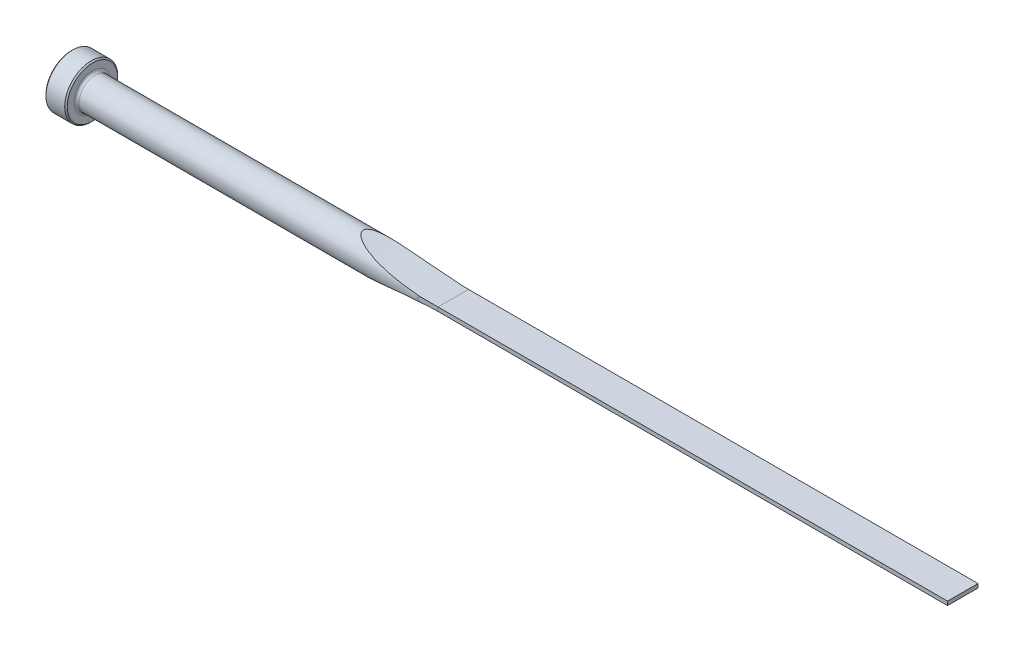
SolidWorks part; units mm, degrees
ref_plane "Front Plane" through (0, 0, 0) normal (0, 0, 1) x (1, 0, 0)
ref_plane "Top Plane" through (0, 0, 0) normal (0, 1, 0) x (1, 0, 0)
ref_plane "Right Plane" through (0, 0, 0) normal (1, 0, 0) x (0, 0, -1)
sketch "Sketch1" plane through (0, 0, 0) normal (0, 0, 1) x (1, 0, 0)
  line L0 (0, 0) -> (175.5286, 0) construction
  line L1 (0, 0) -> (0, 7.9375)
  line L2 (0, 7.9375) -> (6.35, 7.9375)
  line L3 (6.35, 7.9375) -> (6.35, 4.7625)
  line L4 (6.35, 4.7625) -> (266.7, 4.7625)
  line L5 (266.7, 4.7625) -> (266.7, 0)
  line L6 (266.7, 0) -> (0, 0)
  dimension "D1" = 266.7
  dimension "D2" = 15.875
  dimension "D3" = 9.525
  dimension "D4" = 6.35
revolve "Revolve1" add sketch "Sketch1" angle 360 about L0
sketch "Sketch2" plane through (0, 0, 0) normal (0, 0, 1) x (1, 0, 0)
  line L0 (266.7, 4.7625) -> (266.7, 0.5842)
  line L1 (266.7, -4.7625) -> (266.7, 4.7625) construction
  line L2 (266.7, 0.5842) -> (114.3, 0.5842)
  line L3 (266.7, 4.7625) -> (6.35, 4.7625) construction
  line L4 (87.3659, 4.7625) -> (266.7, 4.7625)
  line L5 (166.0833, 0) -> (153.1705, 0) construction
  arc A0 (114.3, 0.5842) -> (87.3659, 4.7625) centre (114.3, 89.4842) cw
  dimension "D1" = 88.9
  dimension "D3" = 152.4
  dimension "D2" = 1.1684
  dimension "D4" = 26.9341
extrude "Cut-Extrude1" cut sketch "Sketch2" against normal through all both and the other way through all
mirror "Mirror1" about plane through (0, 0, 0) normal (0, 1, 0) of "Cut-Extrude1"
sketch "Sketch3" plane through (0, 0, 0) normal (0, 1, 0) x (1, 0, 0)
  line L0 (266.7, 4.7625) -> (266.7, 4.5593)
  line L1 (266.7, 4.7265) -> (266.7, -4.7265) construction
  line L2 (266.7, 4.5593) -> (114.3, 4.5593)
  line L3 (266.7, 4.7625) -> (6.35, 4.7625) construction
  line L4 (108.2927, 4.7625) -> (266.7, 4.7625)
  line L5 (163.4716, 0) -> (166.2513, 0) construction
  line L6 (114.3, 4.7265) -> (114.3, -4.7265) construction
  arc A0 (114.3, 4.5593) -> (108.2927, 4.7625) centre (114.3, 93.4593) cw
  dimension "D2" = 88.9
  dimension "D1" = 9.1186
extrude "Cut-Extrude2" cut sketch "Sketch3" against normal through all both and the other way through all
mirror "Mirror2" about plane through (0, 0, 0) normal (0, 0, 1) of "Cut-Extrude2"
fillet "Fillet1" radius 0.762 1 edges at (6.35, 0, 4.7625)
chamfer "Chamfer1" distance 0.381 angle 45 2 edges at (0, 0, 7.9375) (6.35, 0, 7.9375)
